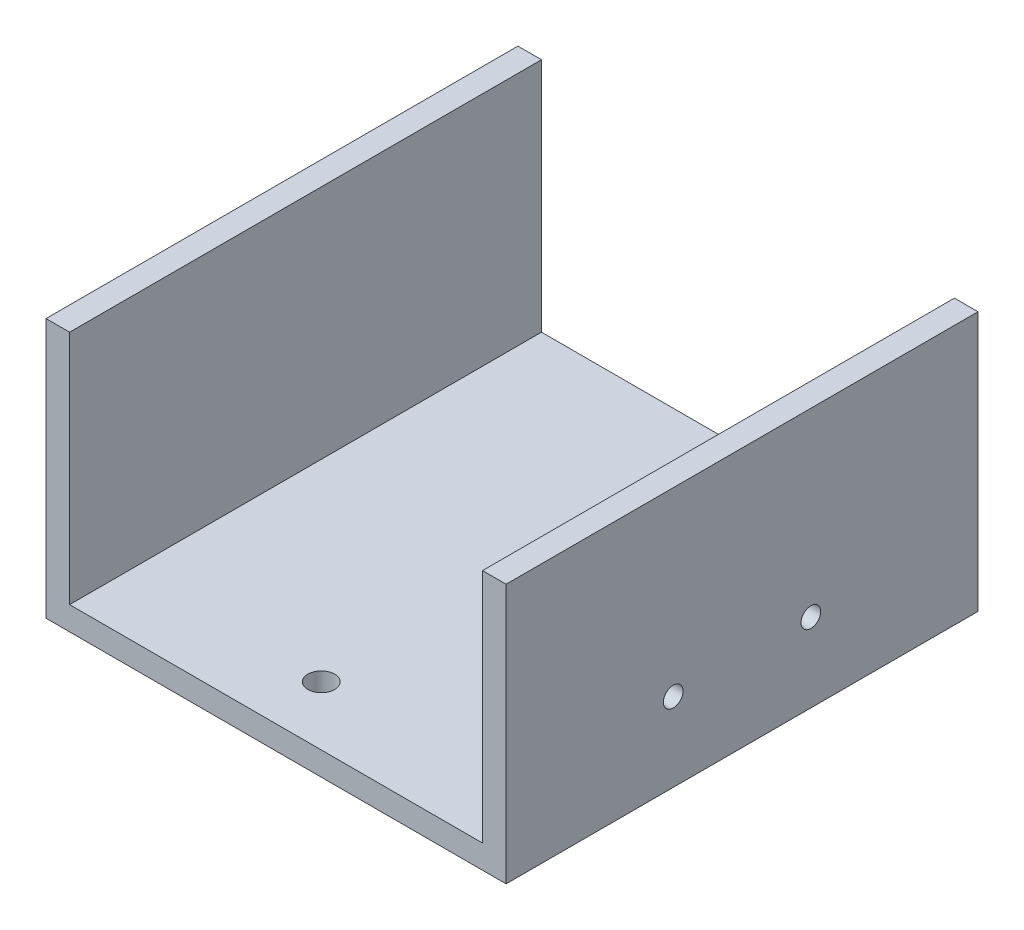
SolidWorks part; units mm, degrees
ref_plane "Plan de face" through (0, 0, 0) normal (0, 0, 1) x (1, 0, 0)
ref_plane "Plan de dessus" through (0, 0, 0) normal (0, 1, 0) x (1, 0, 0)
ref_plane "Plan de droite" through (0, 0, 0) normal (1, 0, 0) x (0, 0, -1)
sketch "Esquisse1" plane through (0, 0, 0) normal (0, 0, 1) x (1, 0, 0)
  line L0 (0, 43.4957) -> (0, -48.9817) construction
  line L1 (-68.153, 0) -> (64.6558, 0) construction
  line L2 (-52.5, -27) -> (52.5, -27)
  line L3 (52.5, -27) -> (52.5, 33)
  line L4 (52.5, 33) -> (58.5, 33)
  line L5 (58.5, 33) -> (58.5, -33)
  line L6 (58.5, -33) -> (-58.5, -33)
  line L7 (-52.5, 33) -> (-58.5, 33)
  line L8 (-52.5, -27) -> (-52.5, 33)
  line L9 (-58.5, 33) -> (-58.5, -33)
  point P10 (0, -27)
  point P15 (0, -33)
  dimension "D1" = 58.5
  dimension "D2" = 66
  dimension "D3" = 6
  dimension "D4" = 6
extrude "Extrusion1" add sketch "Esquisse1" along normal blind 120
hole_wizard "Trou taraudé M82" positions "Esquisse6" profile "Esquisse5" tap size "M8" standard "ISO"
sketch "Esquisse6" plane through (0, -33, 0) normal (0, -1, 0) x (1, 0, 0)
  line L0 (0, -19.0974) -> (0, 137.6829) construction
  line L2 (-66.4656, 60) -> (68.189, 60) construction
  line L4 (-58.5, 0) -> (58.5, 0) construction
  line L5 (-58.5, 120) -> (58.5, 120) construction
  line L6 (-58.5, 120) -> (-58.5, 0) construction
  line L7 (58.5, 120) -> (58.5, 0) construction
  line L8 (46.5, -19.0974) -> (46.5, 139.3746) construction
  line L10 (-66.4656, 15) -> (72.9684, 15) construction
  line L12 (-3.5, -19.0974) -> (-3.5, 142.6826) construction
  point P0 (46.5, 15)
  point P36 (-3.5, 15)
  point P39 (46.5, 105)
  point P40 (-3.5, 105)
  dimension "D1" = 12
  dimension "D2" = 45
  dimension "D3" = 50
sketch "Esquisse5" plane through (46.5, -33, 15) normal (1, 0, 0) x (0, 0, -1)
  line L0 (0, 0) -> (0, 24.2929)
  line L1 (0, 24.2929) -> (3.4, 22.25)
  line L2 (3.4, 22.25) -> (3.4, 0)
  line L5 (3.4, 0) -> (0, 0)
  line L10 (0, 24.2929) -> (-3.4, 22.25) construction
  line L11 (0, -6.35) -> (0, 107.95) construction
  dimension "Diamètre du trou pour taraudage" = 6.8
  dimension "Profondeur du trou pour taraudage" = 22.25
  dimension "Angle de pointe" = 118
hole_wizard "Trou taraudé M61" positions "Esquisse8" profile "Esquisse7" tap size "M6" standard "ISO"
sketch "Esquisse8" plane through (58.5, 0, 0) normal (1, 0, 0) x (0, 0, -1)
  line L0 (-60, 45.3544) -> (-60, -47.8405) construction
  line L2 (0, -33) -> (0, 33) construction
  line L3 (-120, -33) -> (-120, 33) construction
  line L4 (-128.0502, -13) -> (5.5725, -13) construction
  line L6 (-120, -33) -> (0, -33) construction
  line L7 (-42.5, -3.9762) -> (-42.5, -44.8594) construction
  line L9 (-77.5, -3.9762) -> (-77.5, -47.8405) construction
  point P0 (-42.5, -13)
  point P30 (-77.5, -13)
  dimension "D1" = 20
  dimension "D2" = 35
  dimension "D3" = 17.5
sketch "Esquisse7" plane through (58.5, -13, 42.5) normal (0, 1, 0) x (0, 0, -1)
  line L0 (0, 0) -> (0, 18.5022)
  line L1 (0, 18.5022) -> (2.5, 17)
  line L2 (2.5, 17) -> (2.5, 0)
  line L5 (2.5, 0) -> (0, 0)
  line L10 (0, 18.5022) -> (-2.5, 17) construction
  line L11 (0, -6.35) -> (0, 107.95) construction
  dimension "Diamètre du trou pour taraudage" = 5
  dimension "Profondeur du trou pour taraudage" = 17
  dimension "Angle de pointe" = 118
